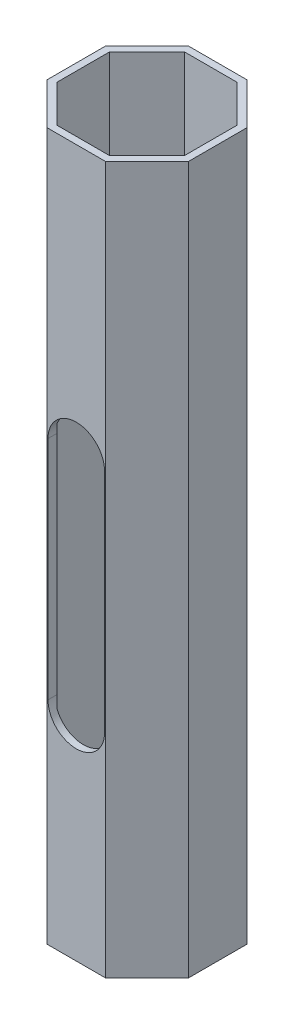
SolidWorks part; units mm, degrees
ref_plane "Plan de face" through (0, 0, 0) normal (0, 0, 1) x (1, 0, 0)
ref_plane "Plan de dessus" through (0, 0, 0) normal (0, 1, 0) x (1, 0, 0)
ref_plane "Plan de droite" through (0, 0, 0) normal (1, 0, 0) x (0, 0, -1)
sketch "Esquisse1" plane through (0, 0, 0) normal (0, 1, 0) x (1, 0, 0)
  line L1 (41.4214, -100) -> (100, -41.4214)
  line L2 (100, -41.4214) -> (100, 41.4214)
  line L3 (100, 41.4214) -> (41.4214, 100)
  line L4 (41.4214, 100) -> (-41.4214, 100)
  line L5 (-41.4214, 100) -> (-100, 41.4214)
  line L6 (-100, 41.4214) -> (-100, -41.4214)
  line L7 (-100, -41.4214) -> (-41.4214, -100)
  line L8 (-41.4214, -100) -> (41.4214, -100)
  circle A0 centre (0, 0) radius 100 construction
  dimension "D1" = 200
extrude "Forme extérieure" add sketch "Esquisse1" along normal blind 1000
shell "Trou" thickness 10
sketch "Esquisse2" plane through (0, 0, 0) normal (0, 0, 1) x (1, 0, 0)
  line L0 (0, 300) -> (0, 620) construction
  line L1 (-40, 300) -> (-40, 620)
  line L2 (40, 300) -> (40, 620)
  line L3 (-41.4214, 0) -> (41.4214, 0) construction
  arc A0 (-40, 300) -> (40, 300) centre (0, 300) ccw
  arc A1 (40, 620) -> (-40, 620) centre (0, 620) ccw
  point P3 (0, 460)
  dimension "D2" = 40
  dimension "D1" = 320
  dimension "D3" = 300
extrude "évidement trappe" cut sketch "Esquisse2" along normal up to next
